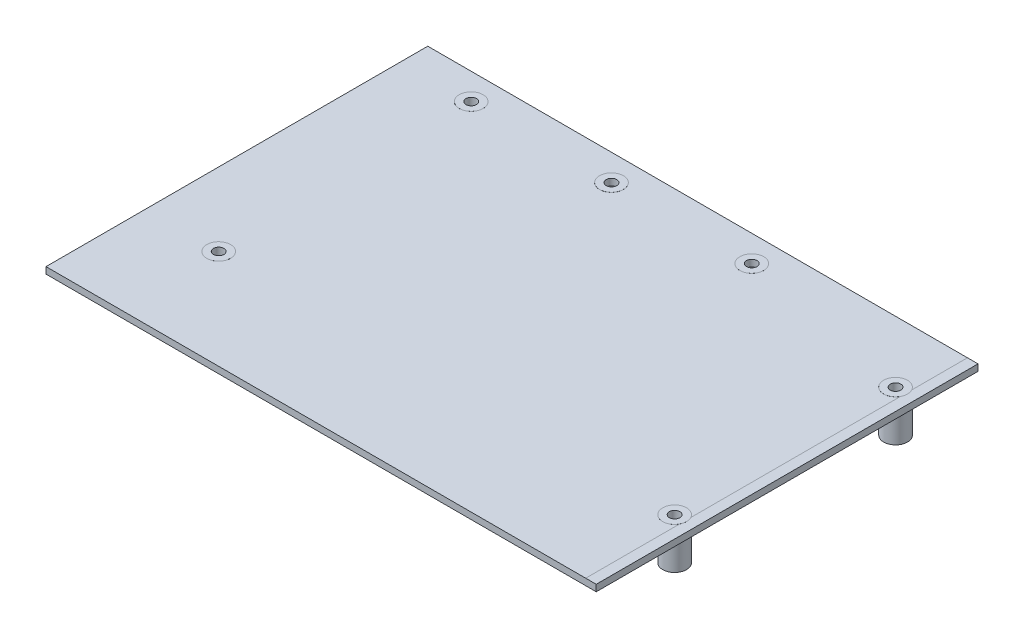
SolidWorks part; units mm, degrees
ref_plane "Front Plane" through (0, 0, 0) normal (0, 0, 1) x (1, 0, 0)
ref_plane "Top Plane" through (0, 0, 0) normal (0, 1, 0) x (1, 0, 0)
ref_plane "Right Plane" through (0, 0, 0) normal (1, 0, 0) x (0, 0, -1)
imported_body "Imported1"
sketch "Sketch3" plane through (0, 2.3622, 0) normal (0, 1, 0) x (1, 0, 0)
  line L1 (172.72, 0) -> (-26.5169, 0)
  line L2 (172.72, 0) -> (172.72, -138.2415)
  line L3 (172.72, -138.2415) -> (-26.5169, -138.2415)
  line L4 (-26.5169, 0) -> (-26.5169, -138.2415)
extrude "Cut-Extrude2" cut sketch "Sketch3" against normal through all and the other way through all flip side to cut
sketch "Sketch1" plane through (0, -0.0127, 0) normal (0, -1, 0) x (1, 0, 0)
  circle A0 centre (165.1, 22.225) radius 1.905 construction
  circle A1 centre (165.1, 22.225) radius 4.318 construction
  circle A2 centre (165.1, 22.225) radius 1.905
  circle A3 centre (165.1, 22.225) radius 4.318
  circle A6 centre (165.1, 102.235) radius 1.905 construction
  circle A7 centre (165.1, 102.235) radius 4.318
  circle A10 centre (165.1, 102.235) radius 4.318
  circle A11 centre (165.1, 102.235) radius 1.905
  circle A14 centre (0, 102.235) radius 1.905 construction
  circle A15 centre (0, 102.235) radius 4.318 construction
  circle A16 centre (-1.27, 9.525) radius 1.905 construction
  circle A17 centre (-1.27, 9.525) radius 4.318 construction
  circle A18 centre (-1.27, 9.525) radius 1.905
  circle A19 centre (-1.27, 9.525) radius 4.318
  circle A22 centre (0, 102.235) radius 1.905
  circle A23 centre (0, 102.235) radius 4.318
  dimension "D1" = 0
extrude "Extrude1" add sketch "Sketch1" along normal blind 12.7
